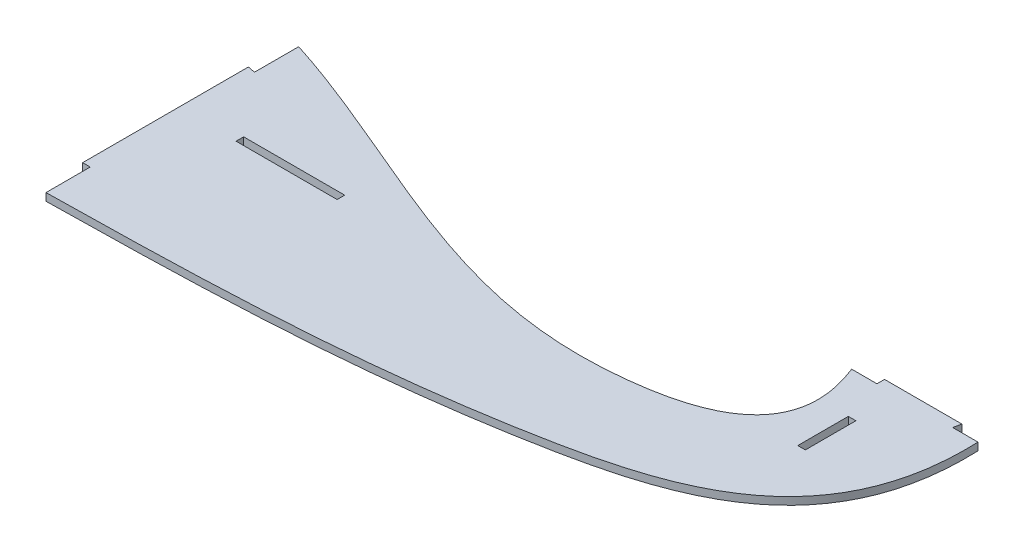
SolidWorks part; units mm, degrees
ref_plane "Plan de face" through (0, 0, 0) normal (0, 0, 1) x (1, 0, 0)
ref_plane "Plan de dessus" through (0, 0, 0) normal (0, 1, 0) x (1, 0, 0)
ref_plane "Plan de droite" through (0, 0, 0) normal (1, 0, 0) x (0, 0, -1)
sketch "Esquisse1" plane through (0, 0, 0) normal (0, 1, 0) x (1, 0, 0)
  line L23 (-206.0351, 82.5) -> (-206.0351, 65)
  line L27 (-186.0351, 40.7173) -> (-146.0351, 40.7173)
  line L28 (-186.0351, 40.7173) -> (-186.0351, 37.7173)
  line L29 (-186.0351, 37.7173) -> (-146.0351, 37.7173)
  line L30 (-146.0351, 40.7173) -> (-146.0351, 37.7173)
  line L31 (29.446, 64.548) -> (32.446, 64.548)
  line L32 (29.446, 64.548) -> (29.446, 44.548)
  line L33 (29.446, 44.548) -> (32.446, 44.548)
  line L34 (32.446, 64.548) -> (32.446, 44.548)
  line L38 (-209.0351, 65) -> (-209.0351, 0)
  line L39 (-209.0351, 0) -> (-206.0351, 0)
  line L40 (-206.0351, 0) -> (-206.0351, -17.5)
  line L41 (-209.0351, 62.3105) -> (-209.0351, 65.6) construction
  line L44 (-206.0351, 65) -> (-209.0351, 65.6)
  line L45 (-209.0351, 65.6) -> (-209.0351, 65)
  line L46 (23.9281, 81.4025) -> (23.9281, 84.4025)
  line L47 (23.9281, 84.4025) -> (53.9281, 84.4025)
  line L48 (13.9281, 81.4025) -> (23.9281, 81.4025)
  line L49 (53.9281, 81.4025) -> (63.9281, 81.4025)
  line L50 (53.9281, 81.4025) -> (54.5281, 84.4025)
  line L51 (54.5281, 84.4025) -> (53.9281, 84.4025)
  spline S0 degree 3 poles (-206.0351, -17.5) (-144.4521, -16.5479) (-43.3393, -14.1174) (66.3683, 18.6536) (63.9281, 81.4025) knots 0 0 0 0 0.576578 1 1 1 1
  spline S1 degree 3 poles (-206.0351, 82.5) (-161.7546, 68.5041) (-103.7358, 34.1507) (-17.8826, 30.4405) (27.9213, 46.25) (13.9281, 81.4025) knots 0 0 0 0 0.541162 0.723272 1 1 1 1
  dimension "D5" = 65
  dimension "D6" = 17.5
  dimension "D7" = 3
  dimension "D8" = 20
  dimension "D12" = 0.6
  dimension "D13" = 3
  dimension "D14" = 100
  dimension "D15" = 40
  dimension "D16" = 20
  dimension "D17" = 3
  dimension "D18" = 30
extrude "Boss.-Extru.1" add sketch "Esquisse1" along normal blind 3
